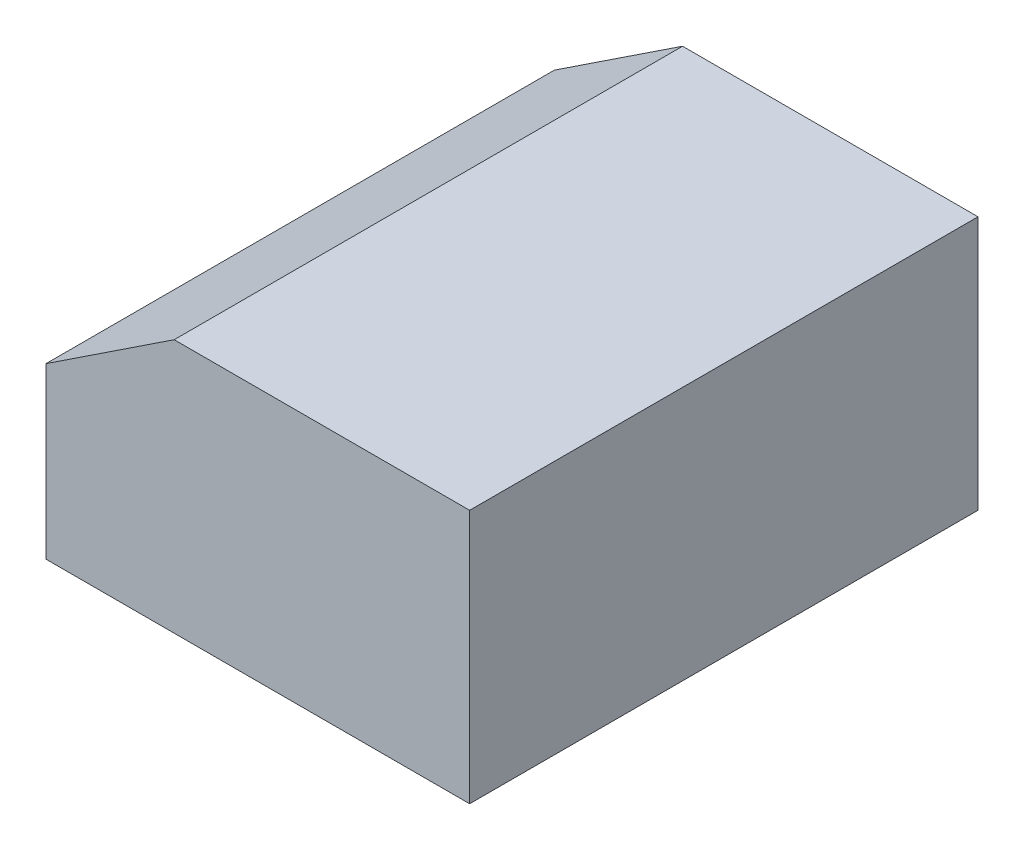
SolidWorks part; units mm, degrees
ref_plane "Face" through (0, 0, 0) normal (0, 0, 1) x (1, 0, 0)
ref_plane "Dessus" through (0, 0, 0) normal (0, 1, 0) x (1, 0, 0)
ref_plane "Droite" through (0, 0, 0) normal (1, 0, 0) x (0, 0, -1)
sketch "Esquisse1" plane through (0, 0, 0) normal (0, 0, 1) x (1, 0, 0)
  line L1 (0, 3.4219) -> (25, 3.4219)
  line L2 (25, 18.4219) -> (7.5652, 18.4219)
  line L3 (0, 13.4172) -> (7.5652, 18.4219)
  line L4 (25, 3.4219) -> (25, 18.4219)
  line L5 (0, 3.4219) -> (0, 13.4172)
  dimension "D1" = 15
  dimension "D2" = 25
  dimension "D3" = 33.486
  dimension "D4" = 9.9953
  dimension "D5" = 17.4348
extrude "Extrusion1" add sketch "Esquisse1" along normal blind 30
